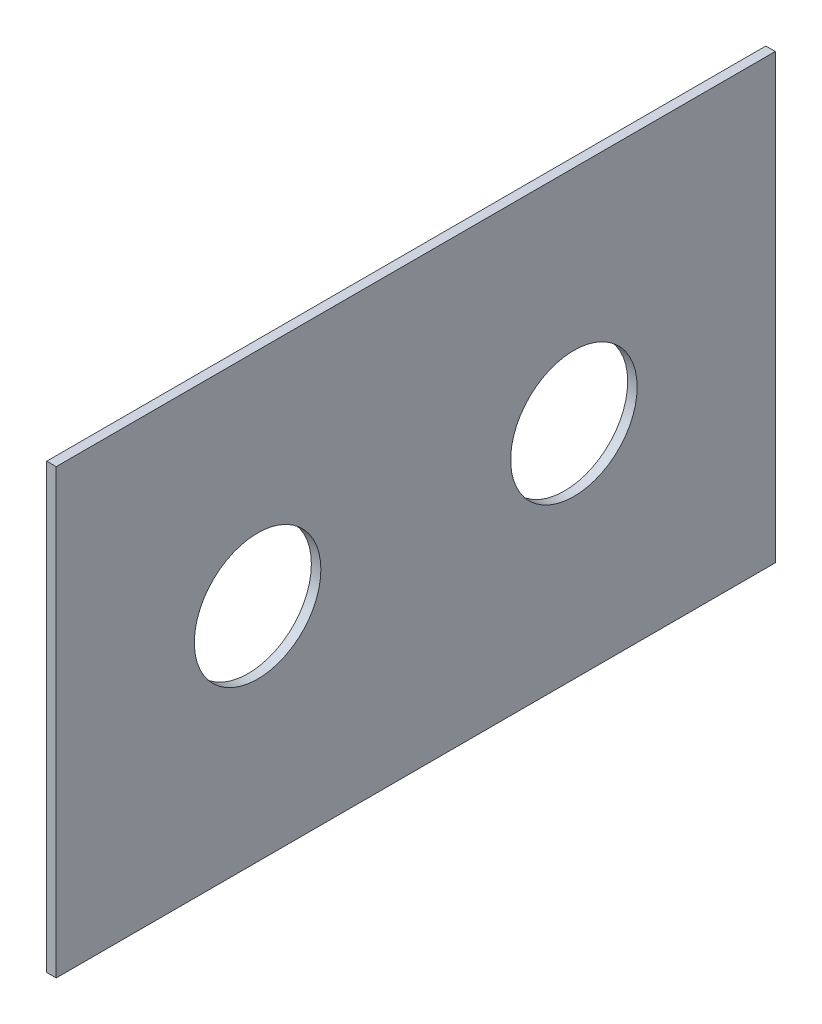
SolidWorks part; units mm, degrees
ref_plane "Front Plane" through (0, 0, 0) normal (0, 0, 1) x (1, 0, 0)
ref_plane "Top Plane" through (0, 0, 0) normal (0, 1, 0) x (1, 0, 0)
ref_plane "Right Plane" through (0, 0, 0) normal (1, 0, 0) x (0, 0, -1)
sketch "Sketch1" plane through (0, 0, 0) normal (1, 0, 0) x (0, 0, -1)
  line L1 (-341, 210) -> (341, 210)
  line L2 (-341, 210) -> (-341, -210)
  line L3 (-341, -210) -> (341, -210)
  line L4 (341, 210) -> (341, -210)
  line L5 (-341, 210) -> (341, -210) construction
  line L6 (-341, -210) -> (341, 210) construction
  point P0 (0, 0)
  dimension "D1" = 682
  dimension "D2" = 420
extrude "Boss-Extrude1" add sketch "Sketch1" along normal blind 9
sketch "Sketch2" plane through (9, 0, 0) normal (1, 0, 0) x (0, 0, -1)
  line L0 (0, 0) -> (-150, 0) construction
  circle A0 centre (-150, 0) radius 60
  circle A1 centre (150, 0) radius 60
  dimension "D1" = 120
  dimension "D2" = 300
  dimension "D3" = 150
extrude "Cut-Extrude1" cut sketch "Sketch2" against normal through all
